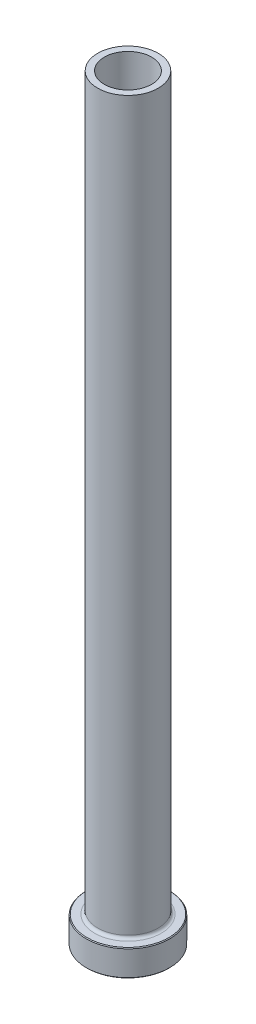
SolidWorks part; units mm, degrees
ref_plane "Front Plane" through (0, 0, 0) normal (0, 0, 1) x (1, 0, 0)
ref_plane "Top Plane" through (0, 0, 0) normal (0, 1, 0) x (1, 0, 0)
ref_plane "Right Plane" through (0, 0, 0) normal (1, 0, 0) x (0, 0, -1)
sketch "Sketch1" plane through (0, 0, 0) normal (0, 0, 1) x (1, 0, 0)
  line L0 (-6.25, 200) -> (-8, 200)
  line L1 (-8, 200) -> (-8, 7)
  line L2 (-8, 7) -> (-11, 7)
  line L3 (-11, 7) -> (-11, 0)
  line L4 (12.1, 0) -> (-12.1, 0) construction
  line L5 (-11, 0) -> (-6.5, 0)
  line L6 (-6.25, 145) -> (-6.25, 200)
  line L7 (0, 92.1877) -> (0, -15.5353) construction
  line L8 (0, -12.1) -> (0, 12.1) construction
  line L9 (-6.25, 145) -> (-6.5, 133)
  line L10 (-6.5, 133) -> (-6.5, 0)
  dimension "D1" = 0.25
  dimension "ID" = 12.5
  dimension "OD" = 16
  dimension "L" = 200
  dimension "H" = 22
  dimension "T" = 7
  dimension "N" = 55
  dimension "D2" = 12
revolve "Revolve1" add sketch "Sketch1" angle 360 about L7
fillet "Fillet1" radius 0.8 1 edges at (0, 7, 8)
chamfer "Chamfer1" distance 0.2 angle 45 2 edges at (0, 7, 11) (0, 0, 11)
chamfer "Chamfer3" distance 0.5 angle 45 1 edges at (0, 0, 6.5)
